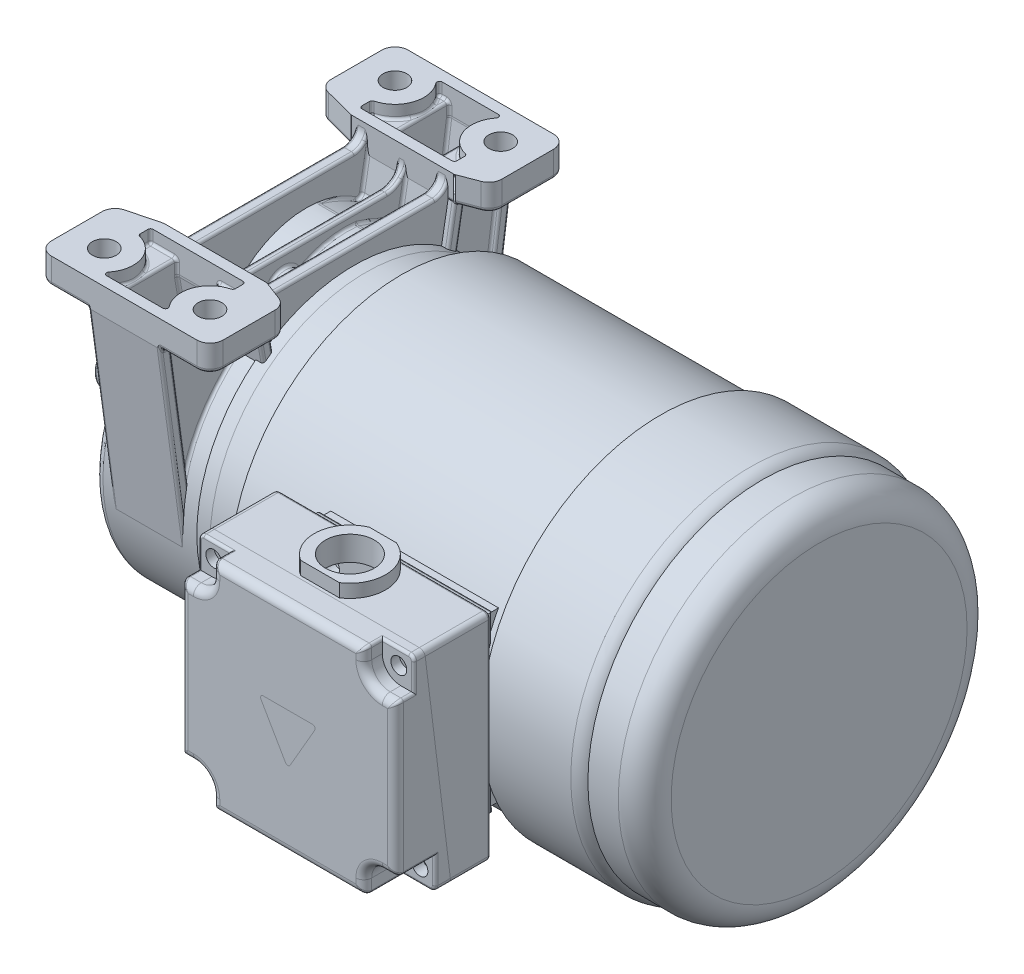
SolidWorks part; units mm, degrees
ref_plane "前视基准面" through (0, 0, 0) normal (0, 0, 1) x (1, 0, 0)
ref_plane "上视基准面" through (0, 0, 0) normal (0, 1, 0) x (1, 0, 0)
ref_plane "右视基准面" through (0, 0, 0) normal (1, 0, 0) x (0, 0, -1)
imported_body "接线盒座-1-surface1"
imported_body "接线盒座-1-surface2"
imported_body "接线盒座-1-surface3"
imported_body "接线盒座-1-surface4"
imported_body "接线盒座-1-surface5"
imported_body "接线盒盖-1-surface1"
imported_body "接线盒盖-1-surface2"
imported_body "接线盒盖-1-surface3"
imported_body "接线盒盖-1-surface4"
imported_body "15.11.08 18B卧式装配体200-1-surface1"
imported_body "15.11.08 18B卧式装配体200-1-surface2"
imported_body "15.11.08 18B卧式装配体200-1-surface3"
imported_body "15.11.08 18B卧式装配体200-1-surface4"
imported_body "15.11.08 18B卧式装配体200-1-surface5"
imported_body "15.11.08 18B卧式装配体200-1-surface6"
imported_body "透气塞-1-surface1"
imported_body "GB／T1096-1979普通平键A型5×25-1-surface1"
sketch "草图1" plane through (-120.5127, 0, 0) normal (1, 0, 0) x (0, 0, -1)
  circle A2 centre (42.8283, -60.533) radius 65
extrude "凸台-拉伸1" add sketch "草图1" along normal blind 98
sketch "草图2" plane through (-22.5127, 0, 0) normal (1, 0, 0) x (0, 0, -1)
  circle A0 centre (42.8283, -60.533) radius 68
extrude "凸台-拉伸2" add sketch "草图2" along normal blind 33.5 separate body
sketch "草图3" plane through (10.9873, 0, 0) normal (1, 0, 0) x (0, 0, -1)
  circle A0 centre (42.8283, -60.533) radius 68
extrude "凸台-拉伸3" add sketch "草图3" along normal blind 5
sketch "草图4" plane through (15.9873, 0, 0) normal (1, 0, 0) x (0, 0, -1)
  circle A0 centre (42.8283, -60.533) radius 66
extrude "凸台-拉伸4" add sketch "草图4" along normal blind 21.5
fillet "圆角1" radius 10 1 edges at (37.4873, -60.533, -108.8283)
fillet "圆角3" radius 6 1 edges at (15.9873, -60.533, -110.8283)
